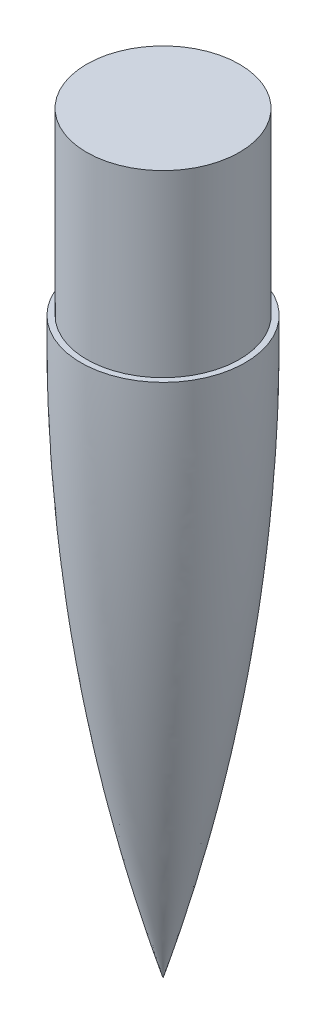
SolidWorks part; units mm, degrees
ref_plane "Front Plane" through (0, 0, 0) normal (0, 0, 1) x (1, 0, 0)
ref_plane "Top Plane" through (0, 0, 0) normal (0, 1, 0) x (1, 0, 0)
ref_plane "Right Plane" through (0, 0, 0) normal (1, 0, 0) x (0, 0, -1)
sketch "Sketch2" plane through (0, 0, 0) normal (0, 0, 1) x (1, 0, 0)
  line L0 (0, 0) -> (0, 203.2)
  line L1 (0, 203.2) -> (-29.083, 203.2)
  arc A0 (0, 0) -> (-29.083, 203.2) centre (654.7809, 197.3968) cw
  dimension "D1" = 29.083
  dimension "D2" = 203.2
revolve "Revolve4" add sketch "Sketch2" angle 360 about L0
sketch "Sketch3" plane through (0, 203.2, 0) normal (0, 1, 0) x (-1, 0, 0)
  circle A0 centre (0, 0) radius 27.051
extrude "Extrude1" add sketch "Sketch3" along normal blind 63.5
